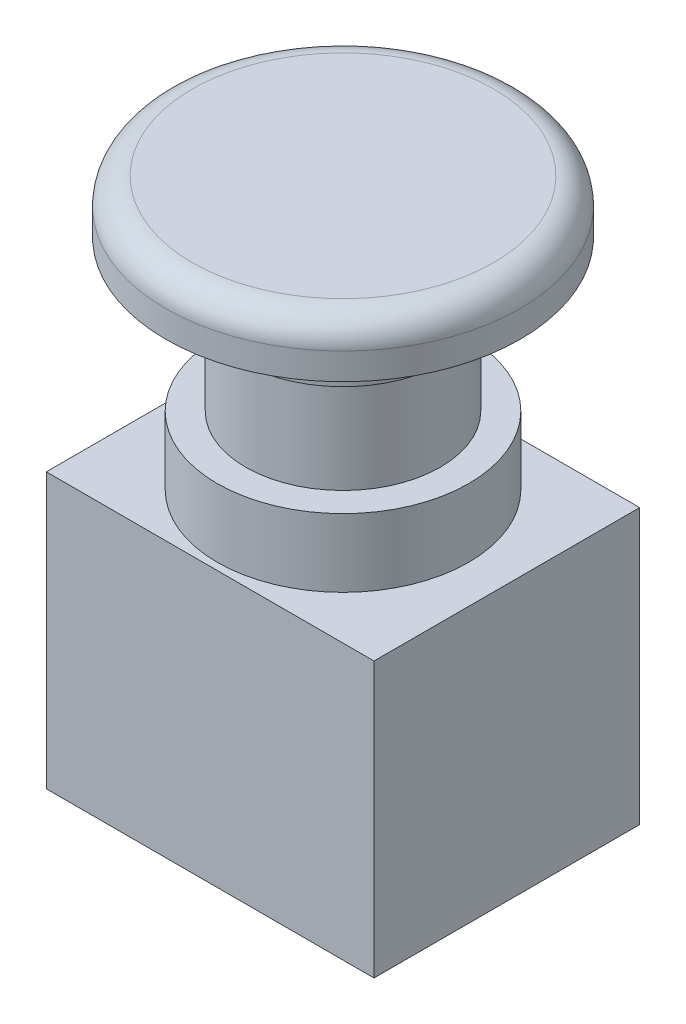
SolidWorks part; units mm, degrees
ref_plane "Alzado" through (0, 0, 0) normal (0, 0, 1) x (1, 0, 0)
ref_plane "Planta" through (0, 0, 0) normal (0, 1, 0) x (1, 0, 0)
ref_plane "Vista lateral" through (0, 0, 0) normal (1, 0, 0) x (0, 0, -1)
sketch "Croquis1" plane through (0, 0, 0) normal (0, 1, 0) x (1, 0, 0)
  line L1 (-18.5, -15) -> (18.5, -15)
  line L2 (-18.5, -15) -> (-18.5, 15)
  line L3 (-18.5, 15) -> (18.5, 15)
  line L4 (18.5, -15) -> (18.5, 15)
  line L5 (-18.5, -15) -> (18.5, 15) construction
  line L6 (-18.5, 15) -> (18.5, -15) construction
  point P0 (0, 0)
  dimension "D1" = 30
  dimension "D2" = 37
extrude "Saliente-Extruir1" add sketch "Croquis1" along normal blind 31
sketch "Croquis2" plane through (0, 31, 0) normal (0, 1, 0) x (1, 0, 0)
  circle A0 centre (0, 0) radius 14.2
  dimension "D1" = 28.4
extrude "Saliente-Extruir2" add sketch "Croquis2" along normal blind 7.7
sketch "Croquis3" plane through (0, 38.7, 0) normal (0, 1, 0) x (1, 0, 0)
  circle A0 centre (0, 0) radius 11
  dimension "D1" = 22
extrude "Saliente-Extruir3" add sketch "Croquis3" along normal blind 10.5
sketch "Croquis4" plane through (0, 49.2, 0) normal (0, 1, 0) x (1, 0, 0)
  circle A0 centre (0, 0) radius 11.5
  dimension "D1" = 23
extrude "Saliente-Extruir4" add sketch "Croquis4" along normal blind 6.5
sketch "Croquis5" plane through (0, 55.7, 0) normal (0, 1, 0) x (1, 0, 0)
  circle A0 centre (0, 0) radius 20
  dimension "D1" = 40
extrude "Saliente-Extruir5" add sketch "Croquis5" along normal blind 6
fillet "Redondeo1" radius 3 1 edges at (0, 61.7, 20)
